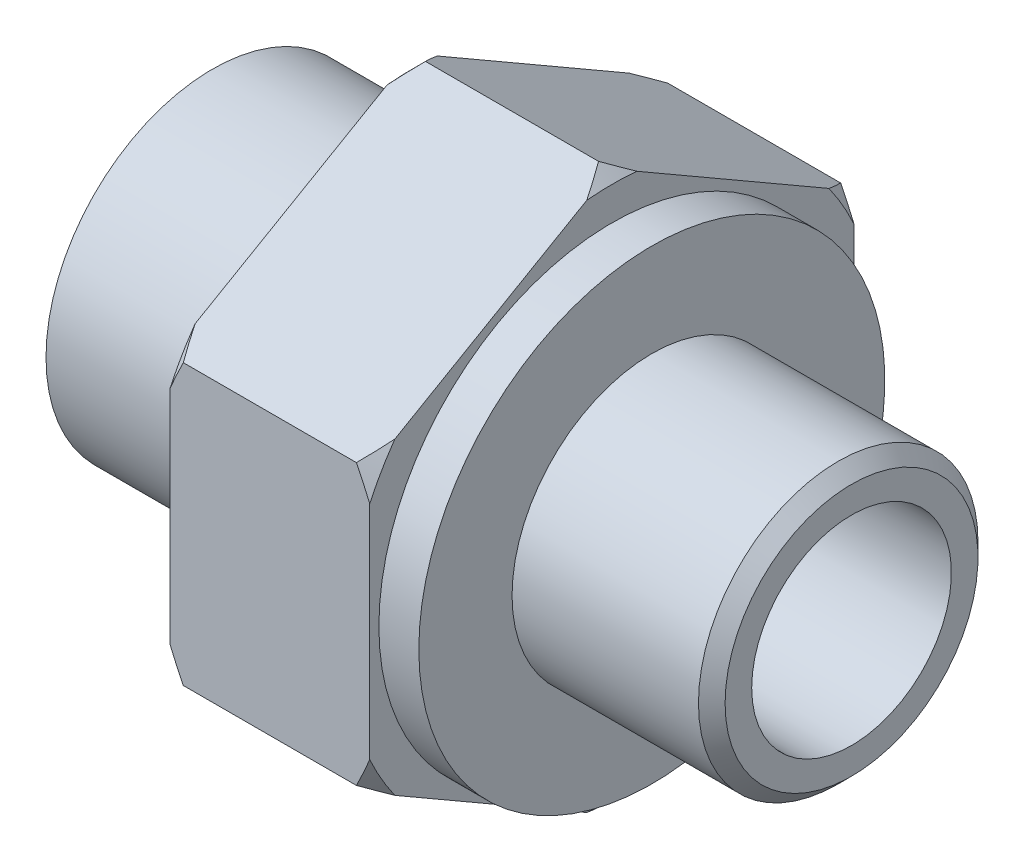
SolidWorks part; units mm, degrees
ref_plane "Face" through (0, 0, 0) normal (0, 0, 1) x (1, 0, 0)
ref_plane "Dessus" through (0, 0, 0) normal (0, 1, 0) x (1, 0, 0)
ref_plane "Droite" through (0, 0, 0) normal (1, 0, 0) x (0, 0, -1)
sketch "Esquisse1" plane through (0, 0, 0) normal (0, 0, 1) x (1, 0, 0)
  line L0 (-49.4342, 0) -> (63.9903, 0) construction
  line L1 (43.5736, 7.5) -> (43.5736, 10.4975)
  line L2 (43.5736, 10.4975) -> (28.5736, 10.4975)
  line L3 (28.5736, 10.4975) -> (28.5736, 17.5)
  line L4 (28.5736, 17.5) -> (25.5736, 17.5)
  line L5 (25.5736, 17.5) -> (25.5736, 21)
  line L6 (25.5736, 21) -> (10.5736, 21)
  line L7 (10.5736, 21) -> (10.5736, 12.5)
  line L8 (-4.4264, 9) -> (23.2984, 9)
  line L9 (23.2984, 9) -> (23.2984, 7.5)
  line L10 (10.5736, 12.5) -> (-4.4264, 12.5)
  line L11 (-4.4264, 12.5) -> (-4.4264, 9)
  line L12 (23.2984, 7.5) -> (43.5736, 7.5)
  dimension "D1" = 20.995
  dimension "D2" = 15
  dimension "D3" = 35
  dimension "D4" = 42
  dimension "D5" = 25
  dimension "D6" = 18
  dimension "D7" = 15
  dimension "D8" = 3
  dimension "D9" = 15
  dimension "D10" = 15
revolve "Révolution1" add sketch "Esquisse1" angle 360 about L0
chamfer "Chanfrein1" distance 1 angle 45 3 edges at (10.5736, 0, 21) (25.5736, 0, 21) (43.5736, 0, 10.4975)
sketch "Esquisse2" plane through (10.5736, 0, 0) normal (-1, 0, 0) x (0, 0, 1)
  line L1 (0, 21) -> (-18.1865, 10.5)
  line L2 (-18.1865, 10.5) -> (-18.1865, -10.5)
  line L3 (-18.1865, -10.5) -> (0, -21)
  line L4 (0, -21) -> (18.1865, -10.5)
  line L5 (18.1865, -10.5) -> (18.1865, 10.5)
  line L6 (18.1865, 10.5) -> (0, 21)
  circle A0 centre (0, 0) radius 18.1865 construction
extrude "Enlèv. mat.-Extru.1" cut sketch "Esquisse2" against normal through all flip side to cut
